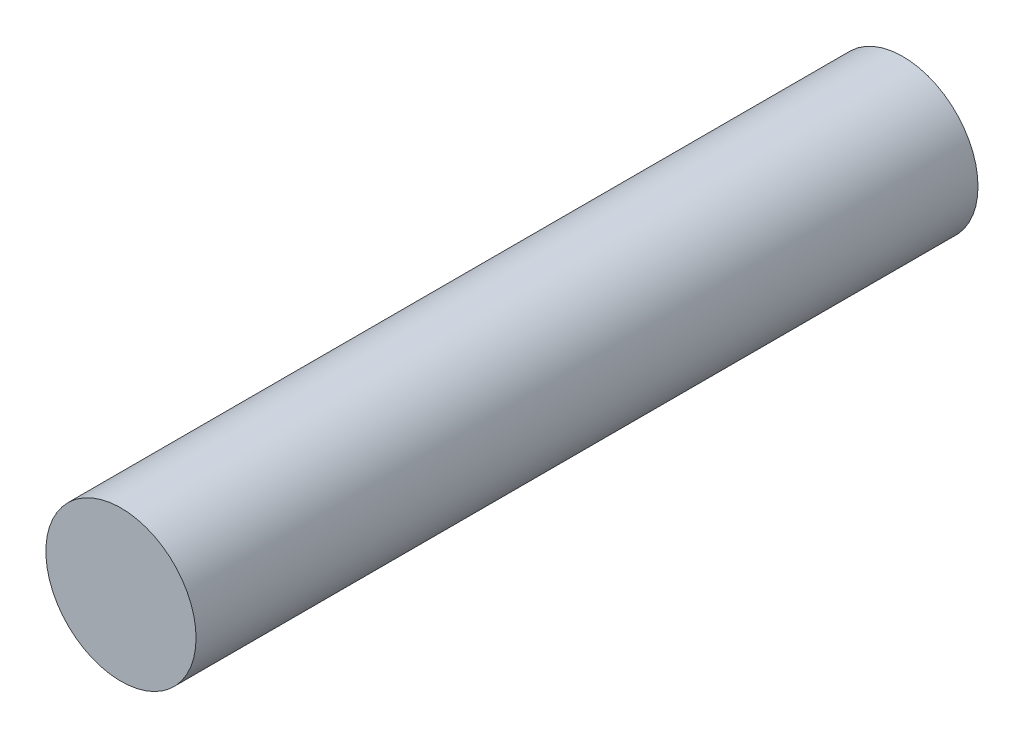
SolidWorks part; units mm, degrees
ref_plane "Front Plane" through (0, 0, 0) normal (0, 0, 1) x (1, 0, 0)
ref_plane "Top Plane" through (0, 0, 0) normal (0, 1, 0) x (1, 0, 0)
ref_plane "Right Plane" through (0, 0, 0) normal (1, 0, 0) x (0, 0, -1)
sketch "Sketch2" plane through (0, 0, 0) normal (0, 0, 1) x (1, 0, 0)
  circle A0 centre (0, 0) radius 4.0005
  dimension "D1" = 8.001
extrude "Boss-Extrude1" add sketch "Sketch2" along normal blind 41.656
